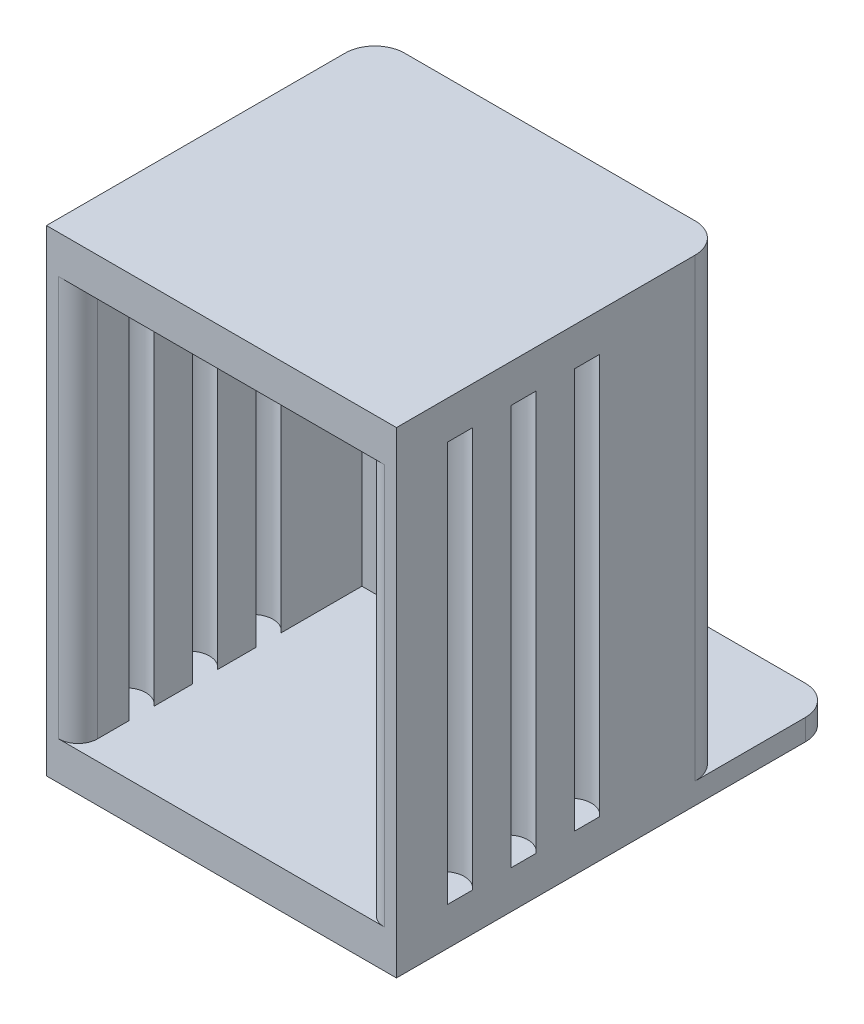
SolidWorks part; units mm, degrees
ref_plane "Front Plane" through (0, 0, 0) normal (0, 0, 1) x (1, 0, 0)
ref_plane "Top Plane" through (0, 0, 0) normal (0, 1, 0) x (1, 0, 0)
ref_plane "Right Plane" through (0, 0, 0) normal (1, 0, 0) x (0, 0, -1)
sketch "Sketch1" plane through (0, 0, 0) normal (0, 1, 0) x (1, 0, 0)
  line L0 (-55, 0) -> (55, 0) construction
  line L1 (-10.4902, 0) -> (10.4902, 0)
  line L2 (-10.4902, 0) -> (-10.4902, 19.685)
  line L3 (-10.4902, 19.685) -> (10.4902, 19.685)
  line L4 (10.4902, 0) -> (10.4902, 19.685)
  line L5 (0, -55) -> (0, 55) construction
  dimension "D1" = 20.9804
  dimension "D2" = 10.4902
  dimension "D3" = 19.685
extrude "Extrude1" add sketch "Sketch1" along normal blind 28.575
sketch "Sketch2" plane through (0, 0, 0) normal (0, 0, 1) x (1, 0, 0)
  line L0 (0, -10.8268) -> (0, 10.8268) construction
  line L1 (-8.5979, 2.286) -> (8.5979, 2.286)
  line L2 (-8.5979, 2.286) -> (-8.5979, 26.289)
  line L3 (-8.5979, 26.289) -> (8.5979, 26.289)
  line L4 (8.5979, 2.286) -> (8.5979, 26.289)
  line L5 (-10.4902, 28.575) -> (10.4902, 28.575) construction
  line L6 (10.8268, 0) -> (-10.8268, 0) construction
  dimension "D1" = 8.5979
  dimension "D2" = 17.1958
  dimension "D3" = 2.286
  dimension "D4" = 2.286
extrude "Cut-Extrude1" cut sketch "Sketch2" against normal blind 17.018
sketch "Sketch3" plane through (0, 0, 0) normal (0, -1, 0) x (1, 0, 0)
  line L0 (10.4902, 0) -> (10.4902, -19.685) construction
  line L1 (-10.4902, -26.289) -> (10.4902, -26.289)
  line L2 (-10.4902, -26.289) -> (-10.4902, -19.685)
  line L3 (-10.4902, -19.685) -> (10.4902, -19.685)
  line L4 (10.4902, -26.289) -> (10.4902, -19.685)
  line L5 (11.5392, 0) -> (-11.5392, 0) construction
  line L6 (-10.4902, -19.685) -> (-10.4902, 0) construction
  line L7 (10.4902, -19.685) -> (-10.4902, -19.685) construction
  dimension "D1" = 26.289
extrude "Extrude2" add sketch "Sketch3" against normal blind 1.27
fillet "Fillet1" radius 1.778 2 edges
ref_plane "Plane1" through (0, 14.2875, 0) normal (0, 1, 0) x (-1, 0, 0)
sketch "Sketch4" plane through (0, 14.2875, 0) normal (0, 1, 0) x (-1, 0, 0)
  line L0 (10.4902, 0) -> (-10.4902, 0) construction
  line L1 (0, 14.4589) -> (0, -14.4589) construction
  line L2 (-9.544, -3.81) -> (-9.544, -10.6386) construction
  circle A0 centre (-9.544, -3.81) radius 1.2065
  circle A1 centre (-9.544, -7.62) radius 1.2065
  circle A2 centre (-9.5441, -11.43) radius 1.2065
  dimension "D1" = 2.413
  dimension "D2" = 2.413
  dimension "D3" = 2.413
  dimension "D4" = 3.81
  dimension "D5" = 3.81
  dimension "D6" = 3.81
  dimension "D7" = 9.544
extrude "Cut-Extrude2" cut sketch "Sketch4" against normal mid plane 24.003
mirror "Mirror1" about plane through (0, 0, 0) normal (1, 0, 0) of "Cut-Extrude2"
fillet "Fillet2" radius 1.778 2 edges at (-10.4902, 0.635, -26.289) (10.4902, 0.635, -26.289)
fillet "Fillet3" radius 1.1684 2 edges at (8.5979, 14.2875, 0) (-8.5979, 14.2875, 0)
